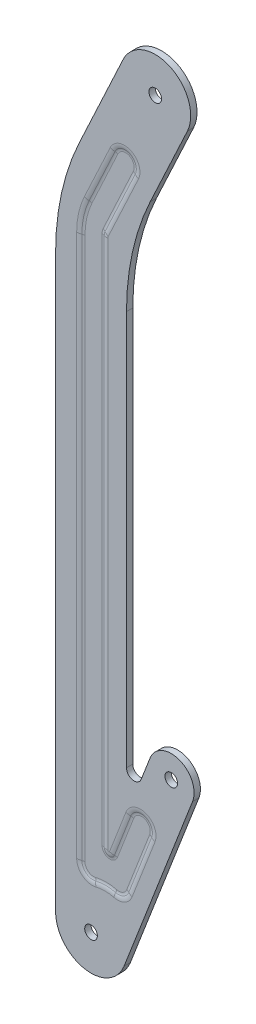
SolidWorks part; units mm, degrees
other "<Levier>-<Outil emboutissage Levier compacteur3>"
ref_plane "Plan de face" through (0, 0, 0) normal (0, 0, 1) x (1, 0, 0)
ref_plane "Plan de dessus" through (0, 0, 0) normal (0, 1, 0) x (1, 0, 0)
ref_plane "Plan de droite" through (0, 0, 0) normal (1, 0, 0) x (0, 0, -1)
sketch "Esquisse1-Levier_Symétrique" plane through (0, 0, 0) normal (0, 0, 1) x (1, 0, 0)
  line L0 (0, 0) -> (0, 244.548) construction
  line L1 (0, 244.548) -> (25.3571, 298.9264) construction
  line L2 (0, 0) -> (31.6964, 67.9731) construction
  line L3 (-14, 0) -> (-14, 225.4822)
  line L4 (-4.6308, 267.7441) -> (12.6688, 304.8431)
  line L5 (38.0454, 293.0098) -> (23.3692, 261.5366)
  line L6 (14, 219.2748) -> (14, 63.2566)
  line L7 (13.0545, -5.0576) -> (40.0886, 64.7218)
  line L8 (19.7974, 62.1728) -> (23.3042, 71.2244)
  arc A0 (-14, 0) -> (13.0545, -5.0576) centre (0, 0) ccw
  arc A1 (38.0454, 293.0098) -> (12.6688, 304.8431) centre (25.3571, 298.9264) ccw
  arc A2 (40.0886, 64.7218) -> (23.3042, 71.2244) centre (31.6964, 67.9731) ccw
  arc A3 (-14, 225.4822) -> (-4.6308, 267.7441) centre (86, 225.4822) cw
  arc A4 (23.3692, 261.5366) -> (14, 219.2748) centre (114, 219.2748) ccw
  arc A5 (14, 63.2566) -> (19.7974, 62.1728) centre (17, 63.2566) ccw
  circle A6 centre (25.3571, 298.9264) radius 2.5
  circle A7 centre (0, 0) radius 2.5
  circle A8 centre (31.6964, 67.9731) radius 2.5
  dimension "D5" = 28
  dimension "D8" = 18
  dimension "D9" = 100
  dimension "D10" = 3
  dimension "D11" = 5
  dimension "D1" = 75
  dimension "D2" = 25
  dimension "D3" = 25
  dimension "D4" = 300
  dimension "D6" = 60
  dimension "D7" = 14
mirrored part "Levier_Symétrique"
